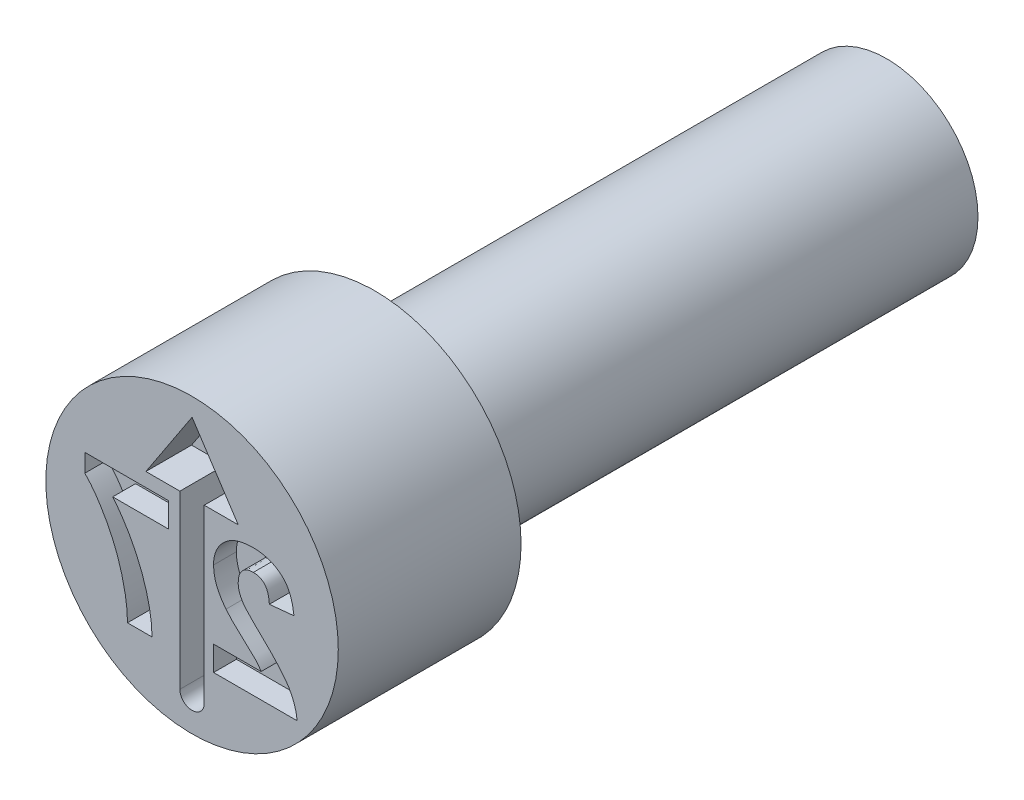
SolidWorks part; units mm, degrees
ref_plane "Front Plane" through (0, 0, 0) normal (0, 0, 1) x (1, 0, 0)
ref_plane "Top Plane" through (0, 0, 0) normal (0, 1, 0) x (1, 0, 0)
ref_plane "Right Plane" through (0, 0, 0) normal (1, 0, 0) x (0, 0, -1)
sketch "Sketch2" plane through (0, 0, 0) normal (1, 0, 0) x (0, 0, -1)
  line L0 (0.4039, 0) -> (50000.4039, 0) construction
  line L6 (0, 0.8) -> (0, 0)
  line L7 (1, 0.8) -> (0, 0.8)
  line L8 (1, 0.5) -> (1, 0.8)
  line L9 (3.8, 0.5) -> (1, 0.5)
  line L10 (3.8, 0) -> (3.8, 0.5)
  line L11 (0, 0) -> (3.8, 0)
  dimension "D1" = 1.6
  dimension "D2" = 1
  dimension "D3" = 3.8
  dimension "D4" = 1
revolve "Revolve1" add sketch "Sketch2" angle 360 about L0
sketch "Sketch3" plane through (0, 0, 0) normal (0, 0, 1) x (1, 0, 0)
  line L0 (0, 0) -> (0, 35000) construction
  line L1 (0.0667, 0.3172) -> (0.0667, -0.6217)
  line L2 (0.2527, 0.3172) -> (0.0667, 0.3172)
  line L3 (0, 0.7007) -> (0.2527, 0.3172)
  line L15 (0, 0.7007) -> (-0.2527, 0.3172)
  line L16 (-0.2527, 0.3172) -> (-0.0667, 0.3172)
  line L17 (-0.0667, 0.3172) -> (-0.0667, -0.6217)
  arc A2 (-0.0667, -0.6217) -> (0.0667, -0.6217) centre (0, -0.6217) ccw
extrude "Cut-Extrude4" cut sketch "Sketch3" against normal blind 0.25
sketch "Sketch4" plane through (0, 0, 0) normal (0, 0, 1) x (1, 0, 0)
  text T0 "2 7" font "Arial" height 0.7
  dimension "D2" = 0.45
extrude "Cut-Extrude5" cut sketch "Sketch4" against normal blind 0.125
